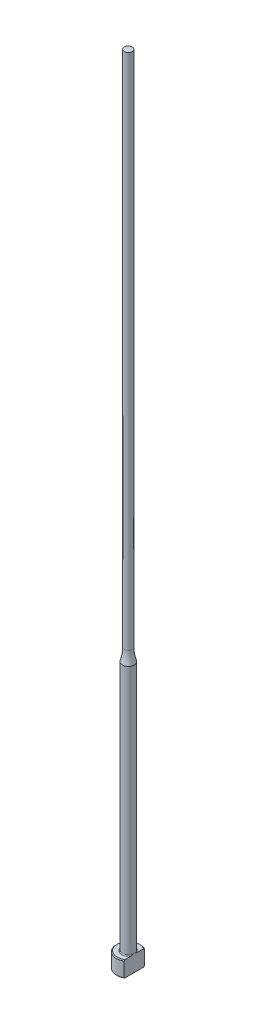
SolidWorks part; units mm, degrees
ref_plane "Front Plane" through (0, 0, 0) normal (0, 0, 1) x (1, 0, 0)
ref_plane "Top Plane" through (0, 0, 0) normal (0, 1, 0) x (1, 0, 0)
ref_plane "Right Plane" through (0, 0, 0) normal (1, 0, 0) x (0, 0, -1)
sketch "Sketch1" plane through (0, 0, 0) normal (0, 0, 1) x (1, 0, 0)
  line L0 (0, 259.9588) -> (0, -15.1925) construction
  line L1 (0, 0) -> (-3, 0)
  line L2 (-3, 0) -> (-3, 4)
  line L3 (-3, 4) -> (-1.5, 4)
  line L4 (-1, 70) -> (-1, 200)
  line L5 (-1, 200) -> (0, 200)
  line L6 (0, 200) -> (0, 0)
  line L7 (-1.5, 4) -> (-1.5, 66.8775)
  arc A0 (-1.5, 66.8775) -> (-1, 70) centre (-11, 70) ccw
  point P13 (-1.5, 0)
  dimension "D1" = 10
  dimension "L" = 200
  dimension "H" = 6
  dimension "T" = 4
  dimension "D" = 2
  dimension "B" = 3
  dimension "S" = 70
revolve "Revolve1" add sketch "Sketch1" angle 360 about L0
chamfer "Chamfer1" distance 0.2 angle 45 2 edges at (0, 4, 3) (0, 0, 3)
fillet "Fillet1" radius 0.2 1 edges at (0, 4, 1.5)
sketch "Sketch2" plane through (0, 0, 0) normal (0, 1, 0) x (1, 0, 0)
  line L0 (1.5, -2.5981) -> (1.5, 2.5981)
  circle A0 centre (0, 0) radius 3 construction
  arc A1 (1.5, -2.5981) -> (1.5, 2.5981) centre (0, 0) ccw
  circle A2 centre (0, 0) radius 1.5 construction
extrude "Keyed Head" cut sketch "Sketch2" along normal through all
